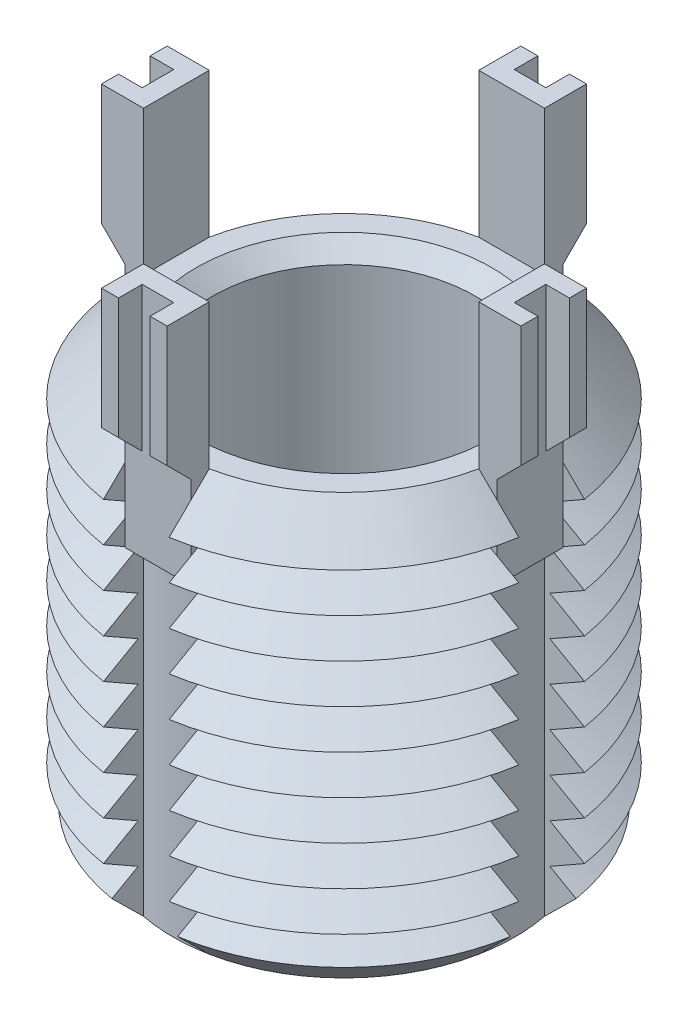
SolidWorks part; units mm, degrees
ref_plane "Front Plane" through (0, 0, 0) normal (0, 0, 1) x (1, 0, 0)
ref_plane "Top Plane" through (0, 0, 0) normal (0, 1, 0) x (1, 0, 0)
ref_plane "Right Plane" through (0, 0, 0) normal (1, 0, 0) x (0, 0, -1)
sketch "Sketch1" plane through (0, 0, 0) normal (0, 1, 0) x (1, 0, 0)
  circle A0 centre (0, 0) radius 8
  dimension "D1" = 16
extrude "Boss-Extrude1" add sketch "Sketch1" against normal blind 16
chamfer "Chamfer1" distance 1.5 angle 45 2 edges at (0, -16, 8) (0, 0, 8)
sketch "Sketch2" plane through (0, 0, 0) normal (1, 0, 0) x (0, 0, -1)
  line L0 (0, 0.8859) -> (0, -9.2617) construction
sketch "Sketch3" plane through (0, 0, 0) normal (1, 0, 0) x (0, 0, -1)
  line L0 (-8, -1.5) -> (-6.701, -2.25)
  line L1 (-6.701, -2.25) -> (-8, -3)
  line L2 (-8, -1.5) -> (-8, -14.5) construction
  line L3 (-8, -3) -> (-8, -1.5)
  dimension "D1" = 1.5
revolve "Cut-Revolve1" cut sketch "Sketch3" angle 360 about L0
pattern_linear "LPattern1" count 9 spacing 1.5 along (0, -1, 0) of "Cut-Revolve1"
sketch "Sketch4" plane through (0, 0, 0) normal (0, 1, 0) x (1, 0, 0)
  line L0 (-6.3787, 1.25) -> (-7.9017, 1.25)
  line L2 (-7.9017, -1.25) -> (-6.3787, -1.25)
  arc A0 (-6.3787, 1.25) -> (-6.3787, -1.25) centre (0, 0) ccw
  arc A1 (-7.9017, 1.25) -> (-7.9017, -1.25) centre (0, 0) ccw
  circle A2 centre (0, 0) radius 8 construction
  circle A3 centre (0, 0) radius 6.5 construction
  point P1 (-6.5, 0)
  point P3 (-8, 0)
  point P13 (0, 0)
  dimension "D1" = 2.5
extrude "Cut-Extrude1" cut sketch "Sketch4" against normal up to surface (16 mm away)
pattern_circular "CirPattern1" count 4 over 360 about axis through (0, 0, 0) along (0, 1, 0) of "Cut-Extrude1"
sketch "Sketch5" plane through (0, 0, 0) normal (1, 0, 0) x (0, 0, -1)
  line L0 (-6.3787, 5.5) -> (-6.3787, -3.5)
  line L1 (-6.3787, -3.5) -> (-7.0787, -3.5)
  line L2 (-7.0787, -3.5) -> (-7.0787, 0)
  line L3 (-7.0787, 0) -> (-7.9787, 0.9)
  line L4 (-7.9787, 0.9) -> (-7.9787, 5.5)
  line L5 (-7.9787, 5.5) -> (-6.3787, 5.5)
  line L6 (-7.9017, -4.5) -> (-1.25, -4.5) construction
  point P9 (-1.25, 0)
  point P10 (-7.0787, 0)
  dimension "D1" = 1
  dimension "D2" = 9
  dimension "D3" = 5.5
  dimension "D4" = 1.6
  dimension "D5" = 0.7
  dimension "D6" = 45
extrude "Boss-Extrude3" add sketch "Sketch5" along normal mid plane 2.5
pattern_circular "CirPattern2" count 4 over 360 about axis through (0, 0, 0) along (0, 1, 0) of "Boss-Extrude3"
sketch "Sketch6" plane through (0, 5.5, 0) normal (0, 1, 0) x (1, 0, 0)
  line L0 (-7.9787, -1.25) -> (-7.9787, 1.25) construction
  line L1 (-7.9787, -0.6) -> (-7.0787, -0.6)
  line L2 (-7.9787, -0.6) -> (-7.9787, 0.6)
  line L3 (-7.9787, 0.6) -> (-7.0787, 0.6)
  line L4 (-7.0787, -0.6) -> (-7.0787, 0.6)
  line L5 (-7.9787, -0.6) -> (-7.0787, 0.6) construction
  line L6 (-7.9787, 0.6) -> (-7.0787, -0.6) construction
  line L7 (7.9787, 1.25) -> (7.9787, -1.25) construction
  line L8 (-0.6, 7.0787) -> (0.6, 7.0787)
  line L9 (-0.6, 7.0787) -> (-0.6, 7.9787)
  line L10 (-0.6, 7.9787) -> (0.6, 7.9787)
  line L11 (0.6, 7.0787) -> (0.6, 7.9787)
  line L12 (-0.6, 7.0787) -> (0.6, 7.9787) construction
  line L13 (-0.6, 7.9787) -> (0.6, 7.0787) construction
  line L14 (7.0787, -0.6) -> (7.9787, -0.6)
  line L15 (7.0787, -0.6) -> (7.0787, 0.6)
  line L16 (7.0787, 0.6) -> (7.9787, 0.6)
  line L17 (7.9787, -0.6) -> (7.9787, 0.6)
  line L18 (7.0787, -0.6) -> (7.9787, 0.6) construction
  line L19 (7.0787, 0.6) -> (7.9787, -0.6) construction
  line L20 (-0.6, -7.9787) -> (0.6, -7.9787)
  line L21 (-0.6, -7.9787) -> (-0.6, -7.0787)
  line L22 (-0.6, -7.0787) -> (0.6, -7.0787)
  line L23 (0.6, -7.9787) -> (0.6, -7.0787)
  line L24 (-0.6, -7.9787) -> (0.6, -7.0787) construction
  line L25 (-0.6, -7.0787) -> (0.6, -7.9787) construction
  line L26 (-1.25, 7.9787) -> (1.25, 7.9787) construction
  line L27 (1.25, -7.9787) -> (-1.25, -7.9787) construction
  point P0 (-7.5287, 0)
  point P7 (-7.9787, 0)
  point P8 (-7.9787, 0)
  point P9 (0, 7.5287)
  point P14 (7.5287, 0)
  point P19 (0, -7.5287)
  point P24 (0, 7.9787)
  point P25 (7.9787, 0)
  point P26 (7.9787, 0)
  point P27 (0, 7.9787)
  point P30 (0, -7.9787)
  point P33 (0, -7.9787)
  dimension "D1" = 1.2
  dimension "D2" = 0.9
extrude "Cut-Extrude3" cut sketch "Sketch6" against normal through all both and the other way through all
sketch "Sketch7" plane through (0, 0, 0) normal (0, 1, 0) x (1, 0, 0)
  circle A0 centre (0, 0) radius 5
  dimension "D1" = 10
extrude "Cut-Extrude4" cut sketch "Sketch7" against normal up to surface (16 mm away)
chamfer "Chamfer2" distance 0.625 angle 45 2 edges at (0, 0, 5) (0, -16, 5)
